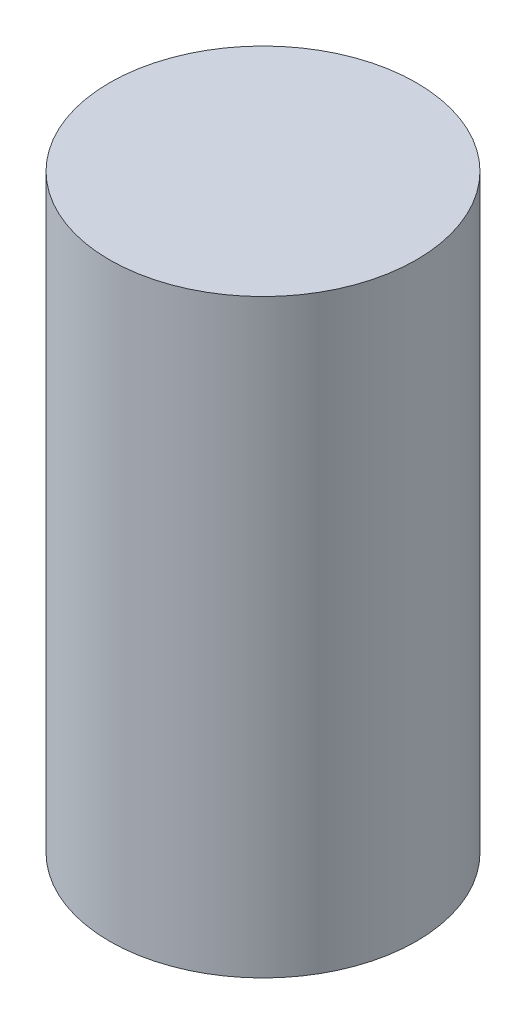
SolidWorks part; units mm, degrees
ref_plane "Front Plane" through (0, 0, 0) normal (0, 0, 1) x (1, 0, 0)
ref_plane "Top Plane" through (0, 0, 0) normal (0, 1, 0) x (1, 0, 0)
ref_plane "Right Plane" through (0, 0, 0) normal (1, 0, 0) x (0, 0, -1)
sketch "Sketch1" plane through (0, 0, 0) normal (0, 1, 0) x (1, 0, 0)
  circle A0 centre (0, 0) radius 41.275
  dimension "D1" = 82.55
extrude "Boss-Extrude1" add sketch "Sketch1" against normal blind 158.75
